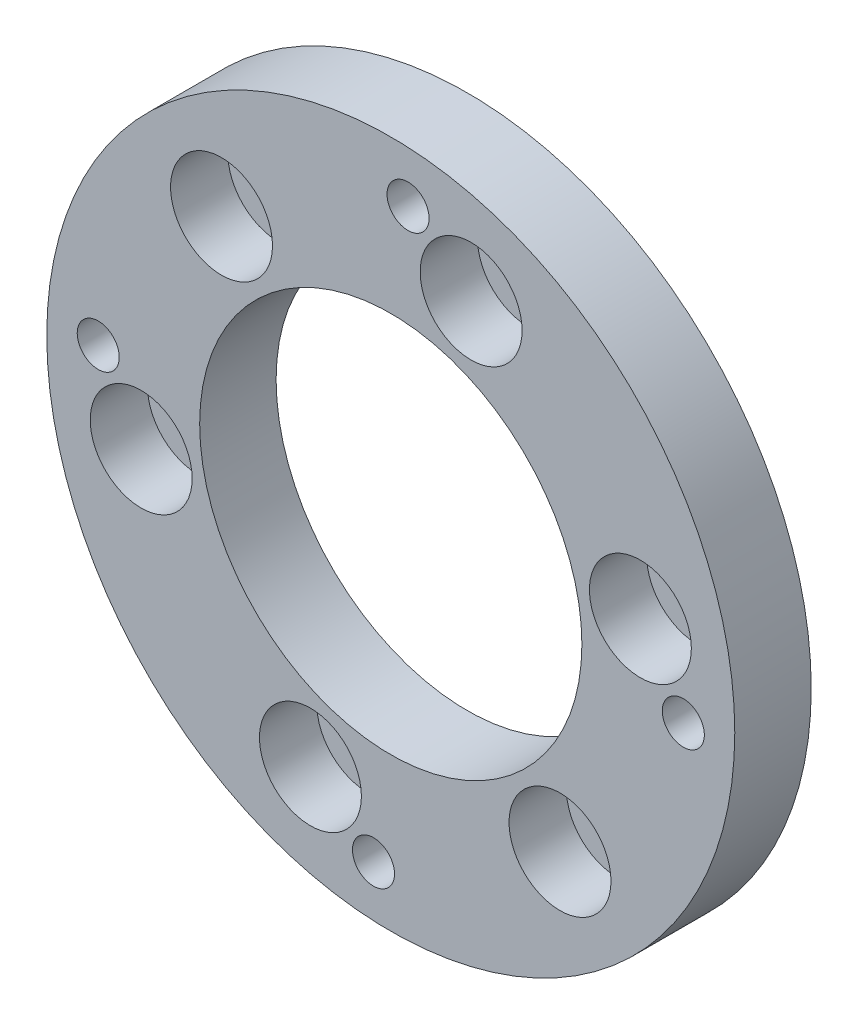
SolidWorks part; units mm, degrees
ref_plane "Plan1" through (0, 0, 0) normal (0, 0, 1) x (1, 0, 0)
ref_plane "Plan2" through (0, 0, 0) normal (0, 1, 0) x (1, 0, 0)
ref_plane "Plan3" through (0, 0, 0) normal (1, 0, 0) x (0, 0, -1)
sketch "Esquisse5" plane through (0, 0, 0) normal (0, 0, 1) x (1, 0, 0)
  circle A0 centre (0, 0) radius 27
  circle A1 centre (0, 0) radius 15
  dimension "D1" = 30
  dimension "D2" = 54
extrude "Base-Extrusion" add sketch "Esquisse5" along normal blind 6
sketch "Esquisse9" plane through (0, 0, 0) normal (0, 0, -1) x (-1, 0, 0)
  circle A0 centre (22.96, 1.3561) radius 2.15 construction
  point P0 (22.96, 1.3561)
hole_wizard "Trou taraudé M4x0.71" positions "Esquisse11" profile "Esquisse10" tap size "M4x0.7" standard "ISO"
sketch "Esquisse11" plane through (0, 0, 0) normal (0, 0, -1) x (-1, 0, 0)
  point P0 (22.96, 1.3561)
sketch "Esquisse10" plane through (-22.96, 1.3561, 0) normal (1, 0, 0) x (0, 1, 0)
  line L0 (0, 0) -> (0, 6)
  line L1 (0, 6) -> (1.65, 6)
  line L2 (1.65, 6) -> (1.65, 0)
  line L5 (1.65, 0) -> (0, 0)
  line L11 (0, -6.35) -> (0, 107.95) construction
  dimension "Diamètre du trou pour taraudage jusqu'au prochain" = 3.3
  dimension "Profondeur du trou pour taraudage jusqu'au prochain" = 6
pattern_circular "Répétition circulaire1" count 4 every 90
sketch "Esquisse12" plane through (0, 0, 6) normal (0, 0, 1) x (1, 0, 0)
  point P0 (-13.2837, 14.9513)
hole_wizard "Chambrage pour vis à tête cylindrique à 6 pans creux (vis CHC) M41" positions "Esquisse16" profile "Esquisse15" counterbore size "M4" standard "ISO"
sketch "Esquisse16" plane through (0, 0, 6) normal (0, 0, 1) x (1, 0, 0)
  point P0 (-13.2837, 14.9513)
sketch "Esquisse15" plane through (-13.2837, 14.9513, 6) normal (1, 0, 0) x (0, -1, 0)
  line L0 (0, 0) -> (0, 6)
  line L1 (0, 6) -> (2.25, 6)
  line L3 (2.25, 6) -> (2.25, 4.5)
  line L4 (2.25, 4.5) -> (4, 4.5)
  line L5 (4, 4.5) -> (4, 0)
  line L7 (4, 0) -> (0, 0)
  line L11 (0, -6.35) -> (0, 107.95) construction
  dimension "Diamètre du perçage jusqu'au prochain" = 4.5
  dimension "Profondeur du perçage jusqu'au prochain" = 6
  dimension "Diamètre du chambrage" = 8
  dimension "Profondeur du chambrage" = 4.5
pattern_circular "Répétition circulaire2" count 6 over 360
